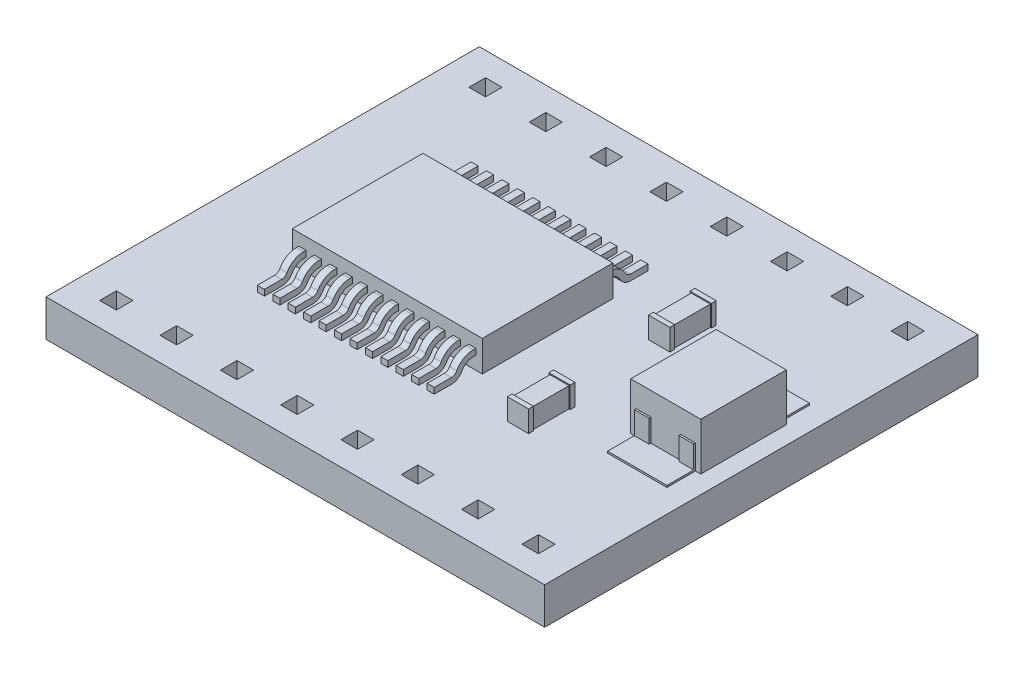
SolidWorks part; units mm, degrees
ref_plane "Спереди" through (0, 0, 0) normal (0, 0, 1) x (1, 0, 0)
ref_plane "Сверху" through (0, 0, 0) normal (0, 1, 0) x (1, 0, 0)
ref_plane "Справа" through (0, 0, 0) normal (1, 0, 0) x (0, 0, -1)
other "Configuration Table"
sketch "Эскиз1" plane through (0, 0, 0) normal (0, 1, 0) x (1, 0, 0)
  line L1 (-10.5, 9.125) -> (10.5, 9.125)
  line L2 (-10.5, 9.125) -> (-10.5, -9.125)
  line L3 (-10.5, -9.125) -> (10.5, -9.125)
  line L4 (10.5, 9.125) -> (10.5, -9.125)
  line L5 (0, -9.125) -> (0, 9.125) construction
  line L6 (-10.5, 0) -> (10.5, 0) construction
  point P0 (0, 0)
  dimension "D1" = 21
  dimension "D2" = 18.25
extrude "Бобышка-Вытянуть1" add sketch "Эскиз1" along normal blind 1.55
sketch "Эскиз2" plane through (0, 1.55, 0) normal (0, 1, 0) x (1, 0, 0)
  line L0 (0, -9.125) -> (0, 9.125) construction
  line L1 (10.5, 9.125) -> (-10.5, 9.125) construction
  line L2 (3.46, 8.125) -> (3.46, 7.425)
  line L3 (0.92, 8.125) -> (1.62, 8.125)
  line L4 (0.92, 8.125) -> (0.92, 7.425)
  line L5 (0.92, 7.425) -> (1.62, 7.425)
  line L6 (1.62, 8.125) -> (1.62, 7.425)
  line L7 (1.27, 7.425) -> (1.27, 8.125) construction
  line L8 (0.92, 7.775) -> (1.62, 7.775) construction
  line L9 (-1.62, 8.125) -> (-0.92, 8.125)
  line L10 (-1.62, 8.125) -> (-1.62, 7.425)
  line L11 (-1.62, 7.425) -> (-0.92, 7.425)
  line L12 (-0.92, 8.125) -> (-0.92, 7.425)
  line L13 (-1.27, 7.425) -> (-1.27, 8.125) construction
  line L14 (-1.62, 7.775) -> (-0.92, 7.775) construction
  line L15 (3.46, 8.125) -> (4.16, 8.125)
  line L16 (4.16, 8.125) -> (4.16, 7.425)
  line L17 (3.46, 7.425) -> (4.16, 7.425)
  line L18 (6, 8.125) -> (6, 7.425)
  line L19 (6, 8.125) -> (6.7, 8.125)
  line L20 (6.7, 8.125) -> (6.7, 7.425)
  line L21 (6, 7.425) -> (6.7, 7.425)
  line L22 (8.54, 8.125) -> (8.54, 7.425)
  line L23 (8.54, 8.125) -> (9.24, 8.125)
  line L24 (9.24, 8.125) -> (9.24, 7.425)
  line L25 (8.54, 7.425) -> (9.24, 7.425)
  line L26 (-8.54, 7.425) -> (-9.24, 7.425)
  line L27 (-9.24, 8.125) -> (-9.24, 7.425)
  line L28 (-8.54, 8.125) -> (-9.24, 8.125)
  line L29 (-8.54, 8.125) -> (-8.54, 7.425)
  line L30 (-6, 7.425) -> (-6.7, 7.425)
  line L31 (-6.7, 8.125) -> (-6.7, 7.425)
  line L32 (-6, 8.125) -> (-6.7, 8.125)
  line L33 (-6, 8.125) -> (-6, 7.425)
  line L34 (-3.46, 7.425) -> (-4.16, 7.425)
  line L35 (-4.16, 8.125) -> (-4.16, 7.425)
  line L36 (-3.46, 8.125) -> (-4.16, 8.125)
  line L37 (-3.46, 8.125) -> (-3.46, 7.425)
  line L38 (0, 0) -> (10.5, 0) construction
  line L39 (10.5, -9.125) -> (10.5, 9.125) construction
  line L40 (-1.62, -7.775) -> (-0.92, -7.775) construction
  line L41 (-1.27, -7.425) -> (-1.27, -8.125) construction
  line L42 (0.92, -7.775) -> (1.62, -7.775) construction
  line L43 (1.27, -7.425) -> (1.27, -8.125) construction
  line L44 (-3.46, -8.125) -> (-3.46, -7.425)
  line L45 (-3.46, -8.125) -> (-4.16, -8.125)
  line L46 (-4.16, -8.125) -> (-4.16, -7.425)
  line L47 (-3.46, -7.425) -> (-4.16, -7.425)
  line L48 (-6, -8.125) -> (-6, -7.425)
  line L49 (-6, -8.125) -> (-6.7, -8.125)
  line L50 (-6.7, -8.125) -> (-6.7, -7.425)
  line L51 (-6, -7.425) -> (-6.7, -7.425)
  line L52 (-8.54, -8.125) -> (-8.54, -7.425)
  line L53 (-8.54, -8.125) -> (-9.24, -8.125)
  line L54 (-9.24, -8.125) -> (-9.24, -7.425)
  line L55 (-8.54, -7.425) -> (-9.24, -7.425)
  line L56 (8.54, -7.425) -> (9.24, -7.425)
  line L57 (9.24, -8.125) -> (9.24, -7.425)
  line L58 (8.54, -8.125) -> (9.24, -8.125)
  line L59 (8.54, -8.125) -> (8.54, -7.425)
  line L60 (6, -7.425) -> (6.7, -7.425)
  line L61 (6.7, -8.125) -> (6.7, -7.425)
  line L62 (6, -8.125) -> (6.7, -8.125)
  line L63 (6, -8.125) -> (6, -7.425)
  line L64 (3.46, -7.425) -> (4.16, -7.425)
  line L65 (4.16, -8.125) -> (4.16, -7.425)
  line L66 (3.46, -8.125) -> (4.16, -8.125)
  line L67 (-0.92, -8.125) -> (-0.92, -7.425)
  line L68 (-1.62, -7.425) -> (-0.92, -7.425)
  line L69 (-1.62, -8.125) -> (-1.62, -7.425)
  line L70 (-1.62, -8.125) -> (-0.92, -8.125)
  line L71 (1.62, -8.125) -> (1.62, -7.425)
  line L72 (0.92, -7.425) -> (1.62, -7.425)
  line L73 (0.92, -8.125) -> (0.92, -7.425)
  line L74 (0.92, -8.125) -> (1.62, -8.125)
  line L75 (3.46, -8.125) -> (3.46, -7.425)
  line L76 (-9.24, 7.775) -> (-8.54, 7.775) construction
  point P5 (1.27, 7.775)
  point P9 (-1.27, 7.775)
  point P86 (-1.27, -7.775)
  point P87 (1.27, -7.775)
  dimension "D1" = 0.7
  dimension "D2" = 2.54
  dimension "D4" = 2.54
  dimension "D5" = 1.35
  dimension "D6" = 0.7
  dimension "D3" = 4
extrude "Вырез-Вытянуть1" cut sketch "Эскиз2" against normal through all
sketch "Эскиз3" plane through (0, 1.55, 0) normal (0, 1, 0) x (1, 0, 0)
  line L0 (-10.5, 9.125) -> (-10.5, -9.125) construction
  line L1 (-6.5, 2.75) -> (1.5, 2.75)
  line L2 (-6.5, 2.75) -> (-6.5, -2.75)
  line L3 (-6.5, -2.75) -> (1.5, -2.75)
  line L4 (1.5, 2.75) -> (1.5, -2.75)
  line L5 (-2.5, -2.75) -> (-2.5, 2.75) construction
  line L6 (-6.5, 0) -> (1.5, 0) construction
  point P0 (-2.5, 0)
  dimension "D1" = 8
  dimension "D2" = 5.5
  dimension "D3" = 4
extrude "Бобышка-Вытянуть2" add sketch "Эскиз3" along normal blind 1.3
sketch "Эскиз4" plane through (0, 1.55, 0) normal (0, 1, 0) x (1, 0, 0)
  line L0 (-2.5, -2.75) -> (-2.5, 2.75) construction
  line L1 (-6.5, -2.75) -> (1.5, -2.75) construction
  line L2 (1.5, 2.75) -> (-6.5, 2.75) construction
  line L3 (-2.325, -2.75) -> (-2.325, -4.5)
  line L4 (-2.325, -4.5) -> (-2.025, -4.5)
  line L5 (-2.025, -4.5) -> (-2.025, -2.75)
  line L6 (-6.5, -2.75) -> (1.5, -2.75) construction
  line L7 (-6.5, 0) -> (1.5, 0) construction
  line L8 (-6.5, 2.75) -> (-6.5, -2.75) construction
  line L9 (1.5, -2.75) -> (1.5, 2.75) construction
  line L10 (-2.325, -2.75) -> (-2.025, -2.75)
  line L11 (-2.325, 2.75) -> (-2.025, 2.75)
  line L12 (-2.025, 4.5) -> (-2.025, 2.75)
  line L13 (-2.325, 4.5) -> (-2.025, 4.5)
  line L14 (-2.325, 2.75) -> (-2.325, 4.5)
  line L15 (-1.675, -2.75) -> (-1.675, -4.5)
  line L16 (-1.675, -4.5) -> (-1.375, -4.5)
  line L17 (-1.375, -4.5) -> (-1.375, -2.75)
  line L18 (-1.675, -2.75) -> (-1.375, -2.75)
  line L19 (-1.675, 2.75) -> (-1.375, 2.75)
  line L20 (-1.375, 4.5) -> (-1.375, 2.75)
  line L21 (-1.675, 4.5) -> (-1.375, 4.5)
  line L22 (-1.675, 2.75) -> (-1.675, 4.5)
  line L23 (-1.025, -2.75) -> (-1.025, -4.5)
  line L24 (-1.025, -4.5) -> (-0.725, -4.5)
  line L25 (-0.725, -4.5) -> (-0.725, -2.75)
  line L26 (-1.025, -2.75) -> (-0.725, -2.75)
  line L27 (-1.025, 2.75) -> (-0.725, 2.75)
  line L28 (-0.725, 4.5) -> (-0.725, 2.75)
  line L29 (-1.025, 4.5) -> (-0.725, 4.5)
  line L30 (-1.025, 2.75) -> (-1.025, 4.5)
  line L31 (-0.375, -2.75) -> (-0.375, -4.5)
  line L32 (-0.375, -4.5) -> (-0.075, -4.5)
  line L33 (-0.075, -4.5) -> (-0.075, -2.75)
  line L34 (-0.375, -2.75) -> (-0.075, -2.75)
  line L35 (-0.375, 2.75) -> (-0.075, 2.75)
  line L36 (-0.075, 4.5) -> (-0.075, 2.75)
  line L37 (-0.375, 4.5) -> (-0.075, 4.5)
  line L38 (-0.375, 2.75) -> (-0.375, 4.5)
  line L39 (0.275, -2.75) -> (0.275, -4.5)
  line L40 (0.275, -4.5) -> (0.575, -4.5)
  line L41 (0.575, -4.5) -> (0.575, -2.75)
  line L42 (0.275, -2.75) -> (0.575, -2.75)
  line L43 (0.275, 2.75) -> (0.575, 2.75)
  line L44 (0.575, 4.5) -> (0.575, 2.75)
  line L45 (0.275, 4.5) -> (0.575, 4.5)
  line L46 (0.275, 2.75) -> (0.275, 4.5)
  line L47 (0.925, -2.75) -> (0.925, -4.5)
  line L48 (0.925, -4.5) -> (1.225, -4.5)
  line L49 (1.225, -4.5) -> (1.225, -2.75)
  line L50 (0.925, -2.75) -> (1.225, -2.75)
  line L51 (0.925, 2.75) -> (1.225, 2.75)
  line L52 (1.225, 4.5) -> (1.225, 2.75)
  line L53 (0.925, 4.5) -> (1.225, 4.5)
  line L54 (0.925, 2.75) -> (0.925, 4.5)
  line L55 (-2.325, -2.75) -> (-1.675, -2.75) construction
  line L56 (-2.675, -2.75) -> (-3.325, -2.75) construction
  line L57 (-5.925, 2.75) -> (-5.925, 4.5)
  line L58 (-5.925, 4.5) -> (-6.225, 4.5)
  line L59 (-6.225, 4.5) -> (-6.225, 2.75)
  line L60 (-5.925, 2.75) -> (-6.225, 2.75)
  line L61 (-5.925, -2.75) -> (-6.225, -2.75)
  line L62 (-6.225, -4.5) -> (-6.225, -2.75)
  line L63 (-5.925, -4.5) -> (-6.225, -4.5)
  line L64 (-5.925, -2.75) -> (-5.925, -4.5)
  line L65 (-5.275, 2.75) -> (-5.275, 4.5)
  line L66 (-5.275, 4.5) -> (-5.575, 4.5)
  line L67 (-5.575, 4.5) -> (-5.575, 2.75)
  line L68 (-5.275, 2.75) -> (-5.575, 2.75)
  line L69 (-5.275, -2.75) -> (-5.575, -2.75)
  line L70 (-5.575, -4.5) -> (-5.575, -2.75)
  line L71 (-5.275, -4.5) -> (-5.575, -4.5)
  line L72 (-5.275, -2.75) -> (-5.275, -4.5)
  line L73 (-4.625, 2.75) -> (-4.625, 4.5)
  line L74 (-4.625, 4.5) -> (-4.925, 4.5)
  line L75 (-4.925, 4.5) -> (-4.925, 2.75)
  line L76 (-4.625, 2.75) -> (-4.925, 2.75)
  line L77 (-4.625, -2.75) -> (-4.925, -2.75)
  line L78 (-4.925, -4.5) -> (-4.925, -2.75)
  line L79 (-4.625, -4.5) -> (-4.925, -4.5)
  line L80 (-4.625, -2.75) -> (-4.625, -4.5)
  line L81 (-3.975, 2.75) -> (-3.975, 4.5)
  line L82 (-3.975, 4.5) -> (-4.275, 4.5)
  line L83 (-4.275, 4.5) -> (-4.275, 2.75)
  line L84 (-3.975, 2.75) -> (-4.275, 2.75)
  line L85 (-3.975, -2.75) -> (-4.275, -2.75)
  line L86 (-4.275, -4.5) -> (-4.275, -2.75)
  line L87 (-3.975, -4.5) -> (-4.275, -4.5)
  line L88 (-3.975, -2.75) -> (-3.975, -4.5)
  line L89 (-3.325, 2.75) -> (-3.325, 4.5)
  line L90 (-3.325, 4.5) -> (-3.625, 4.5)
  line L91 (-3.625, 4.5) -> (-3.625, 2.75)
  line L92 (-3.325, 2.75) -> (-3.625, 2.75)
  line L93 (-3.325, -2.75) -> (-3.625, -2.75)
  line L94 (-3.625, -4.5) -> (-3.625, -2.75)
  line L95 (-3.325, -4.5) -> (-3.625, -4.5)
  line L96 (-3.325, -2.75) -> (-3.325, -4.5)
  line L97 (-2.675, 2.75) -> (-2.675, 4.5)
  line L98 (-2.675, 4.5) -> (-2.975, 4.5)
  line L99 (-2.975, 4.5) -> (-2.975, 2.75)
  line L100 (-2.675, 2.75) -> (-2.975, 2.75)
  line L101 (-2.675, -2.75) -> (-2.975, -2.75)
  line L102 (-2.975, -4.5) -> (-2.975, -2.75)
  line L103 (-2.675, -4.5) -> (-2.975, -4.5)
  line L104 (-2.675, -2.75) -> (-2.675, -4.5)
  dimension "D1" = 9
  dimension "D3" = 0.35
  dimension "D4" = 0.3
  dimension "D5" = 0.35
  dimension "D2" = 6
extrude "Бобышка-Вытянуть4" add sketch "Эскиз4" along normal offset from surface (0.8 mm away) 0.5
sketch "Эскиз5" plane through (-6.5, 0, 0) normal (-1, 0, 0) x (0, 0, 1)
  line L1 (2.75, 1.55) -> (4.5, 1.55) construction
  line L2 (2.75, 1.55) -> (3.7733, 1.55)
  line L3 (2.75, 2.35) -> (4.5, 2.35) construction
  line L4 (-9.125, 1.55) -> (9.125, 1.55) construction
  line L5 (3.7733, 1.55) -> (4.5, 1.55)
  line L6 (4.5, 1.55) -> (4.5, 1.8)
  line L7 (4.5, 2.35) -> (4.5, 1.55) construction
  line L8 (4.5, 1.8) -> (3.7733, 1.8)
  line L9 (2.75, 1.55) -> (2.75, 2.1)
  line L10 (2.75, 2.85) -> (2.75, 1.55) construction
  line L11 (2.75, 2.1) -> (2.85, 2.1)
  line L12 (2.75, 2.35) -> (2.85, 2.35)
  line L13 (4.5, 1.8) -> (4.5, 2.35)
  line L14 (4.5, 2.35) -> (2.85, 2.35)
  line L15 (0, 2.85) -> (0, 1.55) construction
  line L16 (-2.75, 2.85) -> (2.75, 2.85) construction
  line L17 (-4.5, 1.8) -> (-3.7733, 1.8)
  line L18 (-4.5, 2.35) -> (-2.85, 2.35)
  line L19 (-4.5, 1.8) -> (-4.5, 2.35)
  line L20 (-2.75, 1.55) -> (-3.7733, 1.55)
  line L21 (-2.75, 2.1) -> (-2.85, 2.1)
  line L22 (-2.75, 1.55) -> (-2.75, 2.1)
  arc A1 (3.3336, 1.8119) -> (2.85, 2.1) centre (2.85, 1.55) ccw
  arc A2 (3.3336, 1.8119) -> (3.7733, 1.55) centre (3.7733, 2.05) ccw
  arc A3 (2.85, 2.35) -> (3.5535, 1.931) centre (2.85, 1.55) cw
  arc A4 (3.7733, 1.8) -> (3.5535, 1.931) centre (3.7733, 2.05) cw
  arc A5 (-2.85, 2.35) -> (-3.5535, 1.931) centre (-2.85, 1.55) ccw
  arc A6 (-3.7733, 1.8) -> (-3.5535, 1.931) centre (-3.7733, 2.05) ccw
  arc A7 (-3.3336, 1.8119) -> (-2.85, 2.1) centre (-2.85, 1.55) cw
  arc A8 (-3.3336, 1.8119) -> (-3.7733, 1.55) centre (-3.7733, 2.05) cw
  point P3 (3.6454, 1.8352)
  point P38 (3.5174, 1.6204)
  dimension "D5" = 0.25
  dimension "D1" = 0.25
  dimension "D2" = 0.25
  dimension "D3" = 0.1
  dimension "D4" = 0.25
extrude "Вырез-Вытянуть2" cut sketch "Эскиз5" against normal through all contours A7 A8 L20 L21 M12 | L17 A6 A5 L18 L19 | A2 A1 L11 L2 M10 | A4 L8 L13 L14 A3
sketch "Эскиз6" plane through (0, 1.55, 0) normal (0, 1, 0) x (1, 0, 0)
  line L0 (10.5, -9.125) -> (10.5, 9.125) construction
  line L1 (9.75, 1.8) -> (6.8, 1.8)
  line L2 (9.75, 1.8) -> (9.75, -1.8)
  line L3 (9.75, -1.8) -> (6.8, -1.8)
  line L4 (6.8, 1.8) -> (6.8, -1.8)
  line L5 (8.275, -1.8) -> (8.275, 1.8) construction
  line L6 (9.75, 0) -> (6.8, 0) construction
  point P0 (8.275, 0)
  dimension "D1" = 3.6
  dimension "D2" = 2.95
  dimension "D3" = 0.75
extrude "Бобышка-Вытянуть5" add sketch "Эскиз6" along normal offset from surface (2 mm away) 3.55
sketch "Эскиз7" plane through (0, 1.55, 0) normal (0, 1, 0) x (1, 0, 0)
  line L0 (7.025, 1.8) -> (7.025, 3)
  line L1 (9.75, 1.8) -> (6.8, 1.8) construction
  line L2 (7.025, 3) -> (9.525, 3)
  line L3 (9.525, 3) -> (9.525, 1.8)
  line L4 (9.75, 1.8) -> (6.8, 1.8) construction
  line L5 (9.525, 1.8) -> (7.025, 1.8)
  line L6 (9.525, -1.8) -> (7.025, -1.8)
  line L9 (6.8, 0) -> (9.75, 0) construction
  line L10 (6.8, 1.8) -> (6.8, -1.8) construction
  line L11 (9.75, -1.8) -> (9.75, 1.8) construction
  line L12 (9.525, -3) -> (9.525, -1.8)
  line L13 (7.025, -3) -> (9.525, -3)
  line L14 (7.025, -1.8) -> (7.025, -3)
  line L15 (8.275, 1.8) -> (8.275, -3) construction
  dimension "D1" = 6
  dimension "D2" = 2.5
extrude "Бобышка-Вытянуть6" add sketch "Эскиз7" along normal blind 0.075
sketch "Эскиз8" plane through (0, 0, -1.8) normal (0, 0, -1) x (-1, 0, 0)
  line L0 (-9.525, 1.625) -> (-9.525, 2.575)
  line L1 (-9.525, 2.575) -> (-8.9, 2.575)
  line L2 (-8.9, 2.575) -> (-8.9, 1.625)
  line L3 (-9.525, 1.625) -> (-7.025, 1.625) construction
  line L4 (-8.9, 1.625) -> (-9.525, 1.625)
  line L5 (-8.275, 3.55) -> (-8.275, 1.625) construction
  line L6 (-9.75, 3.55) -> (-6.8, 3.55) construction
  line L7 (-7.025, 1.625) -> (-9.525, 1.625) construction
  line L8 (-7.65, 1.625) -> (-7.025, 1.625)
  line L9 (-7.65, 2.575) -> (-7.65, 1.625)
  line L10 (-7.025, 2.575) -> (-7.65, 2.575)
  line L11 (-7.025, 1.625) -> (-7.025, 2.575)
  dimension "D1" = 1.25
  dimension "D2" = 0.95
extrude "Бобышка-Вытянуть7" add sketch "Эскиз8" along normal blind 0.075
mirror "Зеркальное отражение1" about plane through (0, 0, 0) normal (0, 0, 1) of "Бобышка-Вытянуть7"
sketch "Эскиз9" plane through (0, 1.55, 0) normal (0, 1, 0) x (1, 0, 0)
  line L0 (10.5, -9.125) -> (10.5, 9.125) construction
  line L1 (3.8, 3.85) -> (4.6, 3.85)
  line L2 (3.8, 3.85) -> (3.8, 2.1)
  line L3 (3.8, 2.1) -> (4.6, 2.1)
  line L4 (4.6, 3.85) -> (4.6, 2.1)
  line L5 (4.2, 2.1) -> (4.2, 3.85) construction
  line L6 (3.8, 2.975) -> (4.6, 2.975) construction
  line L7 (10.5, 0) -> (-10.5, 0) construction
  line L8 (-10.5, 9.125) -> (-10.5, -9.125) construction
  line L9 (3.8, -2.975) -> (4.6, -2.975) construction
  line L10 (4.2, -2.1) -> (4.2, -3.85) construction
  line L11 (4.6, -3.85) -> (4.6, -2.1)
  line L12 (3.8, -2.1) -> (4.6, -2.1)
  line L13 (3.8, -3.85) -> (3.8, -2.1)
  line L14 (3.8, -3.85) -> (4.6, -3.85)
  point P0 (4.2, 2.975)
  point P18 (4.2, -2.975)
  dimension "D1" = 1.75
  dimension "D2" = 0.8
  dimension "D3" = 5.9
  dimension "D4" = 4.2
extrude "Бобышка-Вытянуть8" add sketch "Эскиз9" along normal offset from surface (0.85 mm away) 2.4
sketch "Эскиз10" plane through (0, 2.4, 0) normal (0, 1, 0) x (1, 0, 0)
  line L0 (4.6, -2.1) -> (3.8, -2.1) construction
  line L1 (3.75, -2) -> (4.65, -2)
  line L2 (3.75, -2) -> (3.75, -2.2)
  line L3 (3.75, -2.2) -> (4.65, -2.2)
  line L4 (4.65, -2) -> (4.65, -2.2)
  line L5 (4.2, -2.2) -> (4.2, -2) construction
  line L6 (3.75, -2.1) -> (4.65, -2.1) construction
  line L7 (3.8, -2.975) -> (4.6, -2.975) construction
  line L8 (3.8, -2.1) -> (3.8, -3.85) construction
  line L9 (4.6, -3.85) -> (4.6, -2.1) construction
  line L10 (3.75, -3.85) -> (4.65, -3.85) construction
  line L11 (4.2, -3.75) -> (4.2, -3.95) construction
  line L12 (4.65, -3.95) -> (4.65, -3.75)
  line L13 (3.75, -3.75) -> (4.65, -3.75)
  line L14 (3.75, -3.95) -> (3.75, -3.75)
  line L15 (3.75, -3.95) -> (4.65, -3.95)
  line L16 (-50, 0) -> (50, 0) construction
  line L17 (4.2, 3.75) -> (4.2, 3.95) construction
  line L18 (3.75, 3.85) -> (4.65, 3.85) construction
  line L19 (3.8, 2.975) -> (4.6, 2.975) construction
  line L20 (3.75, 2.1) -> (4.65, 2.1) construction
  line L21 (4.2, 2.2) -> (4.2, 2) construction
  line L22 (3.75, 3.95) -> (4.65, 3.95)
  line L23 (3.75, 3.95) -> (3.75, 3.75)
  line L24 (3.75, 3.75) -> (4.65, 3.75)
  line L25 (4.65, 3.95) -> (4.65, 3.75)
  line L26 (4.65, 2) -> (4.65, 2.2)
  line L27 (3.75, 2.2) -> (4.65, 2.2)
  line L28 (3.75, 2) -> (3.75, 2.2)
  line L29 (3.75, 2) -> (4.65, 2)
  point P0 (4.2, -2.1)
  point P20 (4.2, -3.85)
  point P41 (4.2, 3.85)
  point P42 (4.2, 2.1)
  dimension "D1" = 0.1
  dimension "D2" = 0.05
extrude "Бобышка-Вытянуть9" add sketch "Эскиз10" against normal blind 2.4 and the other way blind 0.05
ref_plane "Плоскость1" through (8.89, 0, 0) normal (1, 0, 0) x (0, 0, -1)
sketch "Эскиз11" plane through (8.89, 0, 0) normal (1, 0, 0) x (0, 0, -1)
  line L0 (7.775, 1.55) -> (7.775, 0) construction
  line L1 (7.425, 1.55) -> (8.125, 1.55) construction
  line L2 (7.425, 0) -> (8.125, 0) construction
  line L3 (7.775, 3.05) -> (7.275, 3.05)
  line L4 (6.955, 1.55) -> (6.955, 1.6)
  line L5 (-9.125, 1.55) -> (9.125, 1.55) construction
  line L6 (7.775, 3.05) -> (7.775, 1.55)
  line L7 (7.775, 1.55) -> (6.955, 1.55)
  line L9 (9.125, 0.775) -> (-9.125, 0.775) construction
  line L10 (9.125, 1.55) -> (9.125, 0) construction
  line L11 (-9.125, 1.55) -> (-9.125, 0) construction
  line L12 (7.775, 0) -> (6.955, 0)
  line L13 (7.775, -1.5) -> (7.775, 0)
  line L14 (6.955, 0) -> (6.955, -0.05)
  line L15 (7.775, -1.5) -> (7.275, -1.5)
  arc A0 (7.275, 3.05) -> (7.0479, 2.0209) centre (4.8298, 3.05) cw
  arc A1 (6.955, 1.6) -> (7.0479, 2.0209) centre (7.955, 1.6) cw
  arc A2 (6.955, -0.05) -> (7.0479, -0.4709) centre (7.955, -0.05) ccw
  arc A3 (7.275, -1.5) -> (7.0479, -0.4709) centre (4.8298, -1.5) ccw
  dimension "D5" = 1
  dimension "D1" = 1.5
  dimension "D2" = 0.82
  dimension "D3" = 0.05
  dimension "D4" = 0.5
revolve "Повернуть1" [suppressed] add sketch "Эскиз11" angle 360 about L0
fillet "Скругление1" [suppressed] radius 0.1
fillet "Скругление2" [suppressed] radius 0.15
pattern_linear "Линейный массив1" [suppressed] count 8 spacing 2.54
mirror "Зеркальное отражение2" [suppressed] about plane through (0, 0, 0) normal (0, 0, 1)
